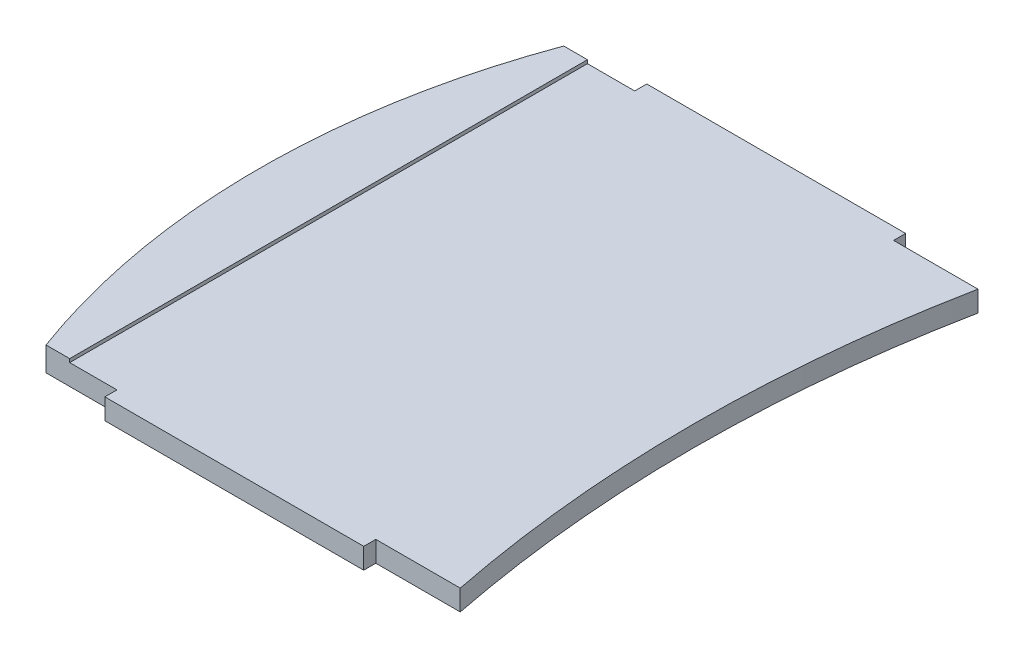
SolidWorks part; units mm, degrees
ref_plane "Front Plane" through (0, 0, 0) normal (0, 0, 1) x (1, 0, 0)
ref_plane "Top Plane" through (0, 0, 0) normal (0, 1, 0) x (1, 0, 0)
ref_plane "Right Plane" through (0, 0, 0) normal (1, 0, 0) x (0, 0, -1)
sketch "Sketch1" plane through (0, 0, 0) normal (0, 1, 0) x (1, 0, 0)
  line L0 (-239.0162, 182.3164) -> (-239.0162, -117.6836)
  line L1 (-239.0162, -117.6836) -> (-177.2162, -117.6836)
  line L2 (45.6138, -117.6836) -> (45.6138, 182.3164)
  line L3 (45.6138, 182.3164) -> (-27.2162, 182.3164)
  line L5 (-239.0162, 32.3164) -> (73.1474, 32.3164) construction
  line L6 (-177.2162, -117.6836) -> (-177.2162, -124.6836)
  line L7 (-177.2162, -124.6836) -> (-27.2162, -124.6836)
  line L8 (-27.2162, -117.6836) -> (-27.2162, -124.6836)
  line L9 (-27.2162, -117.6836) -> (45.6138, -117.6836)
  line L10 (-27.2162, 182.3164) -> (-27.2162, 189.3164)
  line L11 (-177.2162, 182.3164) -> (-177.2162, 189.3164)
  line L12 (-177.2162, 189.3164) -> (-27.2162, 189.3164)
  line L13 (-177.2162, 182.3164) -> (-239.0162, 182.3164)
  dimension "D1" = 284.63
  dimension "D2" = 300
  dimension "D3" = 61.8
  dimension "D4" = 72.83
  dimension "D5" = 7
extrude "Boss-Extrude1" add sketch "Sketch1" along normal blind 12
sketch "Sketch2" plane through (0, 0, 0) normal (0, -1, 0) x (1, 0, 0)
  line L0 (-239.0162, 117.6836) -> (-239.0162, -182.3164)
  arc A0 (-239.0162, 117.6836) -> (-239.0162, -182.3164) centre (92.2541, -32.3164) ccw
extrude "Boss-Extrude2" add sketch "Sketch2" against normal blind 14
sketch "Sketch4" plane through (0, 0, 0) normal (0, -1, 0) x (1, 0, 0)
  line L0 (-239.0162, 117.6836) -> (-177.2162, 117.6836) construction
  line L1 (-177.2162, -182.3164) -> (-239.0162, -182.3164) construction
  line L2 (-231.9562, 117.6836) -> (-231.9562, -182.3164) construction
  line L3 (-231.9562, 117.6836) -> (-231.9562, 156.6734)
  line L4 (-231.9562, 156.6734) -> (-361.9844, 13.9714)
  line L5 (-361.9844, 13.9714) -> (-301.7324, -154.8925)
  line L6 (-301.7324, -154.8925) -> (-263.8523, -210.0454)
  line L7 (-263.8523, -210.0454) -> (-231.9562, -182.3164)
  arc A0 (-231.9562, 117.6836) -> (-231.9562, -182.3164) centre (33.5835, -32.3164) ccw
  dimension "D1" = 7.06
  dimension "D2" = 7.06
extrude "Cut-Extrude2" cut sketch "Sketch4" against normal blind 14
sketch "Sketch5" plane through (0, 0, 0) normal (0, -1, 0) x (1, 0, 0)
  line L0 (21.7038, 117.6836) -> (21.7038, -182.3164) construction
  line L1 (-27.2162, 117.6836) -> (45.6138, 117.6836) construction
  line L2 (45.6138, -182.3164) -> (-27.2162, -182.3164) construction
  line L3 (45.6138, 117.6836) -> (45.6138, -182.3164) construction
  line L4 (21.7038, 117.6836) -> (70.6575, 137.8267)
  line L5 (70.6575, 137.8267) -> (78.5695, -196.7369)
  line L6 (78.5695, -196.7369) -> (21.7038, -196.7369)
  line L7 (21.7038, -196.7369) -> (21.7038, -182.3164)
  line L8 (21.7038, -182.3164) -> (21.7038, 117.6836)
  dimension "D1" = 23.91
extrude "Cut-Extrude3" cut sketch "Sketch5" against normal blind 14
sketch "Sketch6" plane through (0, 0, 0) normal (0, -1, 0) x (1, 0, 0)
  line L0 (-271.3941, -32.3164) -> (-232.3841, -32.3164) construction
  line L1 (-231.9562, 117.6836) -> (-177.2162, 117.6836) construction
  line L2 (-177.2162, -182.3164) -> (-231.9562, -182.3164) construction
  line L3 (-204.5862, 117.6836) -> (-222.3406, 193.5778)
  line L4 (-222.3406, 193.5778) -> (-399.9479, -71.2185)
  line L5 (-399.9479, -71.2185) -> (-232.322, -239.1382)
  line L6 (-232.322, -239.1382) -> (-204.5862, -182.3164)
  arc A0 (-231.9562, 117.6836) -> (-231.9562, -182.3164) centre (33.5835, -32.3164) ccw construction
  arc A1 (-204.5862, 117.6836) -> (-204.5862, -182.3164) centre (187.1597, -32.3164) ccw
  dimension "D1" = 39.01
extrude "Cut-Extrude4" cut sketch "Sketch6" against normal blind 14
sketch "Sketch9" plane through (0, 0, 0) normal (0, -1, 0) x (1, 0, 0)
  line L0 (-204.5862, 117.6836) -> (-218.3133, 117.6836)
  line L1 (-204.5862, -182.3164) -> (-218.3133, -182.3164)
  line L2 (-204.5862, 117.6836) -> (-204.5862, -182.3164)
  arc A0 (-218.3133, 117.6836) -> (-218.3133, -182.3164) centre (188.7998, -32.3164) ccw
extrude "Boss-Extrude4" add sketch "Sketch9" against normal blind 14
sketch "Sketch10" plane through (0, 0, 0) normal (0, -1, 0) x (-1, 0, 0)
  line L0 (-21.7038, -117.6836) -> (-21.7038, 182.3164)
  arc A0 (-21.7038, -117.6836) -> (-21.7038, 182.3164) centre (-775.8937, 32.3164) ccw
extrude "Cut-Extrude6" cut sketch "Sketch10" against normal blind 14
